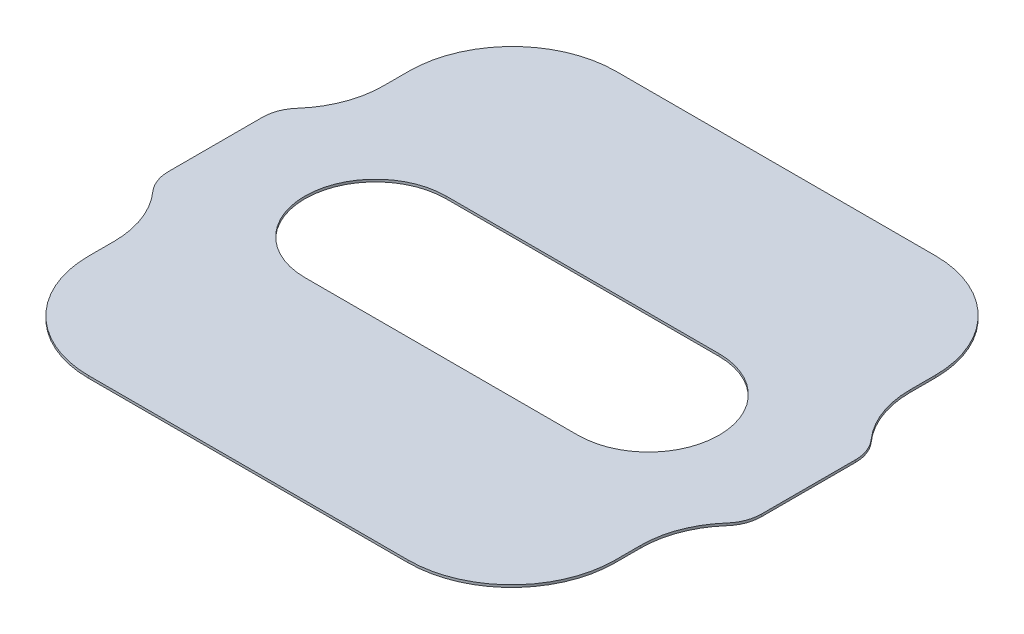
SolidWorks part; units mm, degrees
ref_plane "Front Plane" through (0, 0, 0) normal (0, 0, 1) x (1, 0, 0)
ref_plane "Top Plane" through (0, 0, 0) normal (0, 1, 0) x (1, 0, 0)
ref_plane "Right Plane" through (0, 0, 0) normal (1, 0, 0) x (0, 0, -1)
sketch "Sketch3" plane through (0, 0, 0) normal (0, 1, 0) x (1, 0, 0)
  line L0 (20.6415, -3.0308) -> (17.2491, -3.0308)
  line L1 (21.7415, -4.1305) -> (21.7415, -4.4007)
  line L2 (22.0953, -5.3308) -> (22.0953, -6.3308)
  line L3 (18.9453, -3.0308) -> (18.9453, -8.6308) construction
  line L4 (22.0953, -5.8308) -> (15.7953, -5.8308) construction
  line L5 (15.7953, -5.3308) -> (15.7953, -6.3308)
  line L6 (16.1491, -4.1305) -> (16.149, -4.4007)
  line L7 (21.7415, -7.531) -> (21.7415, -7.2608)
  line L8 (20.6415, -8.6308) -> (17.2491, -8.6308)
  line L9 (16.1491, -7.531) -> (16.149, -7.2608)
  arc A0 (20.6415, -3.0308) -> (21.7415, -4.1305) centre (20.6415, -4.1308) cw
  arc A1 (21.7415, -4.4007) -> (21.9942, -5.065) centre (22.7415, -4.4005) ccw
  arc A2 (21.9942, -5.065) -> (22.0953, -5.3308) centre (21.6953, -5.3308) cw
  arc A3 (15.8963, -5.065) -> (15.7953, -5.3308) centre (16.1953, -5.3308) ccw
  arc A4 (16.149, -4.4007) -> (15.8963, -5.065) centre (15.149, -4.4005) cw
  arc A5 (17.2491, -3.0308) -> (16.1491, -4.1305) centre (17.2491, -4.1308) ccw
  arc A6 (21.9942, -6.5965) -> (22.0953, -6.3308) centre (21.6953, -6.3308) ccw
  arc A7 (21.7415, -7.2608) -> (21.9942, -6.5965) centre (22.7415, -7.261) cw
  arc A8 (20.6415, -8.6308) -> (21.7415, -7.531) centre (20.6415, -7.5308) ccw
  arc A9 (17.2491, -8.6308) -> (16.1491, -7.531) centre (17.2491, -7.5308) cw
  arc A10 (16.149, -7.2608) -> (15.8963, -6.5965) centre (15.149, -7.261) ccw
  arc A11 (15.8963, -6.5965) -> (15.7953, -6.3308) centre (16.1953, -6.3308) cw
  dimension "D1" = 3.3924
extrude "Boss-Extrude3" add sketch "Sketch3" along normal blind 0.0254
sketch "Sketch4" plane through (0, 0.0254, 0) normal (0, 1, 0) x (1, 0, 0)
  line L0 (15.7953, -5.8308) -> (22.0953, -5.8308) construction
  line L1 (15.7953, -5.3308) -> (15.7953, -6.3308) construction
  line L2 (22.0953, -6.3308) -> (22.0953, -5.3308) construction
  line L3 (17.4953, -5.8308) -> (20.3953, -5.8308) construction
  line L4 (17.4953, -5.0808) -> (20.3953, -5.0808)
  line L5 (17.4953, -6.5808) -> (20.3953, -6.5808)
  arc A0 (17.4953, -5.0808) -> (17.4953, -6.5808) centre (17.4953, -5.8308) ccw
  arc A1 (20.3953, -6.5808) -> (20.3953, -5.0808) centre (20.3953, -5.8308) ccw
  point P8 (18.9453, -5.8308)
  dimension "D1" = 0.75
  dimension "D2" = 2.9
extrude "Cut-Extrude2" cut sketch "Sketch4" against normal through all
